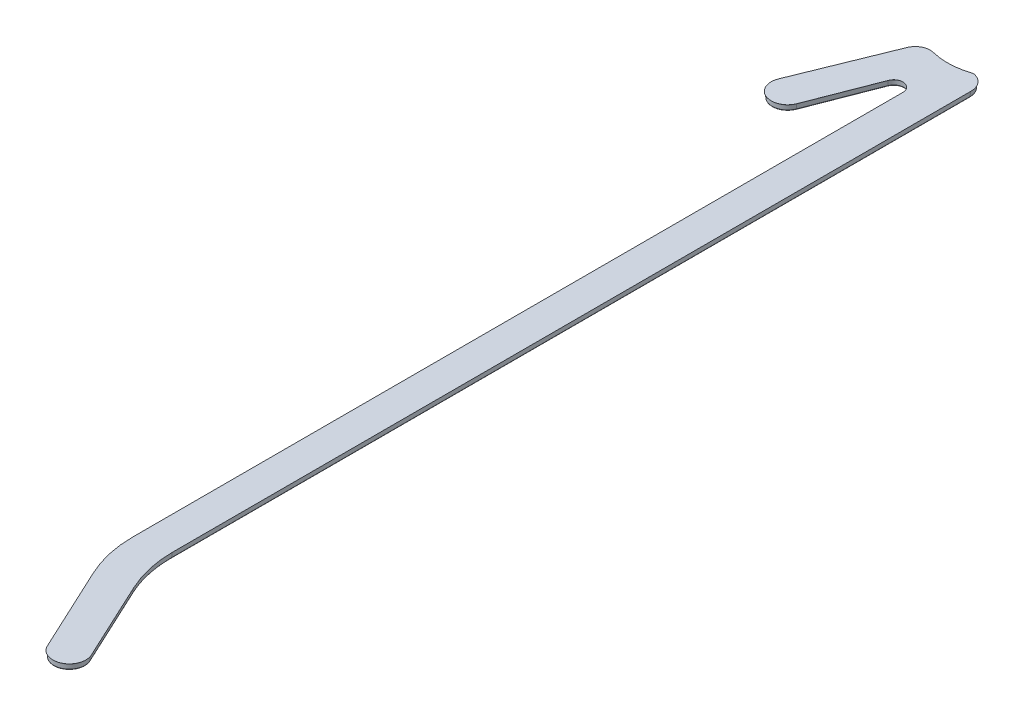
SolidWorks part; units mm, degrees
ref_plane "Plane1" through (0, 0, 0) normal (0, 0, 1) x (1, 0, 0)
ref_plane "Plane2" through (0, 0, 0) normal (0, 1, 0) x (1, 0, 0)
ref_plane "Plane3" through (0, 0, 0) normal (1, 0, 0) x (0, 0, -1)
sketch "Sketch1" plane through (0, 0, 0) normal (0, 0, 1) x (1, 0, 0)
  line L0 (-40, 5) -> (40, 5)
  line L1 (-40, 5) -> (-40, 0)
  line L2 (40, 0) -> (-40, 0)
  line L3 (40, 0) -> (40, 5)
  line L4 (0, 5) -> (0, 0) construction
  line L5 (50, 0) -> (-50, 0) construction
  dimension "D1" = 80
  dimension "D2" = 5
extrude "Base-Extrude" add sketch "Sketch1" along normal blind 300 and the other way blind 30
sketch "Sketch10" plane through (0, 0, 0) normal (0, 1, 0) x (-1, 0, 0)
  line L4 (2.5, 97.5) -> (2.5, -97.5) construction
  line L5 (0, 50) -> (0, -50) construction
  line L6 (-2.5, 97.5) -> (-2.5, -97.5) construction
  line L8 (-2.5, 0) -> (2.5, 0) construction
  arc A0 (2.5, -97.5) -> (-2.5, -97.5) centre (0, -97.5) cw construction
  arc A1 (-2.5, 97.5) -> (2.5, 97.5) centre (0, 97.5) cw construction
  dimension "Rib Length" = 200
  dimension "Rib Width" = 5
ref_plane "Plane4" through (0, 0, -97.5) normal (0, 0, 1) x (1, 0, 0)
ref_plane "Plane5" through (0, 0, 97.5) normal (0, 0, 1) x (1, 0, 0)
sketch "Sketch2" plane through (0, 0, -97.5) normal (0, -1, 0) x (1, 0, 0)
  line L1 (0, 97.5) -> (0, 307.5) construction
  line L2 (-4, 106.4577) -> (-4, 301.7359)
  line L3 (4, 97.5) -> (4, 306.6132)
  line L4 (0, 307.5) -> (12.6785, 334.6892) construction
  line L5 (-1.1892, 314.4145) -> (9.0533, 336.3797)
  line L6 (4, 306.6132) -> (16.3038, 332.9988)
  line L7 (0, 97.5) -> (-10, 97.5) construction
  line L8 (-10, 97.5) -> (-19.0325, 120.8112) construction
  line L9 (-13.3508, 96.142) -> (-22.7396, 119.3089)
  line L10 (-8.8311, 105.5545) -> (-15.3027, 122.2564)
  line L11 (-5, 97.5) -> (-5, 77.5) construction
  arc A0 (0.6118, 93.5471) -> (4, 97.5) centre (0, 97.5) ccw
  arc A1 (-13.3508, 96.142) -> (-9.1231, 93.9924) centre (-10, 97.5) ccw
  arc A2 (-15.3027, 122.2564) -> (-22.7396, 119.3089) centre (-19.0325, 120.8112) ccw
  arc A3 (16.3038, 332.9988) -> (9.0533, 336.3797) centre (12.6785, 334.6892) ccw
  arc A4 (-1.1892, 314.4145) -> (-4, 301.7359) centre (26, 301.7359) ccw
  arc A5 (0.6118, 93.5471) -> (-9.1231, 93.9924) centre (-5, 77.5) ccw
  arc A6 (-8.8311, 105.5545) -> (-4, 106.4577) centre (-6.5, 106.4577) ccw
  point P2 (0, 97.5)
  point P3 (-20.9967, 117.3267)
  point P6 (0.6118, 93.5471)
  point P23 (-19.0325, 121.1782)
  point P27 (-16.5453, 114.3924)
  point P28 (-22.7388, 119.3068)
  point P29 (-12.992, 99.5298)
  point P30 (0, 0)
  dimension "D1" = 4
  dimension "D3" = 4
  dimension "D6" = 10
  dimension "D7" = 4
  dimension "D10" = 20
  dimension "D12" = 4
  dimension "D11" = 5
  dimension "D13" = 30
  dimension "D14" = 17
  dimension "D2" = 210
  dimension "D4" = 30
  dimension "D5" = 155
  dimension "D8" = 25
  dimension "D9" = 21.18
extrude "Boss-Extrude1" add sketch "Sketch2" along normal blind 1.5 draft 3
sketch "Sketch7" plane through (0, -1.5, 0) normal (0, -1, 0) x (1, 0, 0)
  line L0 (0, 0.9975) -> (0, -17.5521) construction
  line L1 (0, 0) -> (0, -2)
  line L2 (3.9214, 0) -> (3.9214, 209.1306)
  line L3 (3.9214, 0) -> (3.9214, 209.1306)
  line L6 (-3.9214, 8.9577) -> (-3.9214, 204.2359)
  line L7 (-3.9214, 8.9577) -> (-3.9214, 204.2359)
  line L10 (3.9214, 209.1306) -> (16.2325, 235.532)
  line L11 (3.9214, 209.1306) -> (16.2325, 235.532)
  line L12 (-1.118, 216.8813) -> (9.1246, 238.8465)
  line L13 (-1.118, 216.8813) -> (9.1246, 238.8465)
  line L16 (-8.9044, 8.0261) -> (-15.376, 24.728)
  line L17 (-8.9044, 8.0261) -> (-15.376, 24.728)
  line L18 (-13.278, -1.3285) -> (-22.6668, 21.8384)
  line L19 (-13.278, -1.3285) -> (-22.6668, 21.8384)
  arc A2 (0.619, -3.8722) -> (3.9214, 0) centre (0, 0) ccw
  arc A3 (0.619, -3.8722) -> (3.9214, 0) centre (0, 0) ccw
  arc A4 (16.2325, 235.532) -> (9.1246, 238.8465) centre (12.6785, 237.1892) ccw
  arc A5 (16.2325, 235.532) -> (9.1246, 238.8465) centre (12.6785, 237.1892) ccw
  arc A7 (-1.118, 216.8813) -> (-3.9214, 204.2359) centre (26, 204.2359) ccw
  arc A8 (-1.118, 216.8813) -> (-3.9214, 204.2359) centre (26, 204.2359) ccw
  arc A13 (-8.9044, 8.0261) -> (-3.9214, 8.9577) centre (-6.5, 8.9577) ccw
  arc A14 (-8.9044, 8.0261) -> (-3.9214, 8.9577) centre (-6.5, 8.9577) ccw
  arc A15 (-15.376, 24.728) -> (-22.6668, 21.8384) centre (-19.0325, 23.3112) ccw
  arc A16 (-15.376, 24.728) -> (-22.6668, 21.8384) centre (-19.0325, 23.3112) ccw
  arc A17 (-13.278, -1.3285) -> (-9.1422, -3.4313) centre (-10, 0) ccw
  arc A18 (-13.278, -1.3285) -> (-9.1422, -3.4313) centre (-10, 0) ccw
  arc A19 (0.619, -3.8722) -> (-9.1422, -3.4313) centre (-5, -20) ccw
  arc A20 (0.619, -3.8722) -> (-9.1422, -3.4313) centre (-5, -20) ccw
  point P6 (0, -17.5521)
  point P15 (0, 0)
  dimension "D1" = 0
fillet "Congé1" radius 30 1 edges at (3.9607, -0.75, 209.1219)
fillet "Congé2" radius 0.2 28 edges at (-20.5063, 0, 27.0298) (-18.0452, 0, 10.2254) (-11.6387, 0, -3.2229) (-4.2231, 0, -3.0178) (3.037, 0, -2.6032) (4, 0, 101.2357) (4.7101, 0, 208.9558) (-12.0669, 0, 16.4055) (-6.0406, 0, 6.5003) (-4, 0, 106.5968) (-3.2889, 0, 210.7291) (3.932, 0, 227.8971) (14.369, 0, 240.8145) (4.0033, -1.5, 227.8639) (14.3358, -1.5, 240.7432) (11.4804, -1.5, 225.341) (4.6315, -1.5, 208.9732) (3.9214, -1.5, 101.2445) (2.9837, -1.5, -2.5446) (-4.2294, -1.5, -2.9388) (-11.603, -1.5, -3.1528) (-17.9724, -1.5, 10.255) (-20.4773, -1.5, 26.9567) (-12.1402, -1.5, 16.3771) (-6.0261, -1.5, 6.4231) (-3.9214, -1.5, 106.5968) (-3.2121, -1.5, 210.7121) (11.5553, 0, 225.3157)
sketch "Sketch3" plane through (-40, 0, 0) normal (-1, 0, 0) x (0, 0, 1)
  line L4 (-30, 0) -> (300, 0)
  line L5 (300, 0) -> (300, 5)
  line L6 (300, 5) -> (-30, 5)
  line L7 (-30, 5) -> (-30, 0)
  line L8 (-30, 0) -> (300, 0)
  line L9 (300, 0) -> (300, 5)
  line L10 (300, 5) -> (-30, 5)
  line L11 (-30, 5) -> (-30, 0)
  dimension "D1" = 0
extrude "Cut-Extrude1" cut sketch "Sketch3" against normal through all
sketch "Orientation Sketch" plane through (0, 0, 0) normal (0, 1, 0) x (-1, 0, 0)
  line L2 (-4.1898, 202.4737) -> (-4.1898, 0)
  line L3 (-4.1898, 202.4737) -> (-4.1898, 0)
  line L4 (13.5267, -1.4293) -> (22.9155, 21.7376)
  line L5 (13.5267, -1.4293) -> (22.9155, 21.7376)
  line L10 (15.1257, 24.825) -> (8.6542, 8.1231)
  line L11 (15.1257, 24.825) -> (8.6542, 8.1231)
  line L12 (4.1898, 8.9577) -> (4.1898, 204.2359)
  line L13 (4.1898, 8.9577) -> (4.1898, 204.2359)
  line L14 (1.3612, 216.9947) -> (-8.8813, 238.9599)
  line L15 (1.3612, 216.9947) -> (-8.8813, 238.9599)
  line L16 (-16.4758, 235.4186) -> (-6.978, 215.0505)
  line L17 (-16.4758, 235.4186) -> (-6.978, 215.0505)
  arc A2 (-4.1898, 0) -> (-0.5932, -4.1476) centre (0, 0) ccw
  arc A3 (-4.1898, 0) -> (-0.5932, -4.1476) centre (0, 0) ccw
  arc A4 (9.0771, -3.6917) -> (-0.5932, -4.1476) centre (5, -20) ccw
  arc A5 (9.0771, -3.6917) -> (-0.5932, -4.1476) centre (5, -20) ccw
  arc A11 (9.0771, -3.6917) -> (13.5267, -1.4293) centre (10, 0) ccw
  arc A12 (9.0771, -3.6917) -> (13.5267, -1.4293) centre (10, 0) ccw
  arc A13 (22.9155, 21.7376) -> (15.1257, 24.825) centre (19.0325, 23.3112) ccw
  arc A14 (22.9155, 21.7376) -> (15.1257, 24.825) centre (19.0325, 23.3112) ccw
  arc A15 (4.1898, 8.9577) -> (8.6542, 8.1231) centre (6.5, 8.9577) ccw
  arc A16 (4.1898, 8.9577) -> (8.6542, 8.1231) centre (6.5, 8.9577) ccw
  arc A17 (4.1898, 204.2359) -> (1.3612, 216.9947) centre (-26, 204.2359) ccw
  arc A18 (4.1898, 204.2359) -> (1.3612, 216.9947) centre (-26, 204.2359) ccw
  arc A19 (-8.8813, 238.9599) -> (-16.4758, 235.4186) centre (-12.6785, 237.1892) ccw
  arc A20 (-8.8813, 238.9599) -> (-16.4758, 235.4186) centre (-12.6785, 237.1892) ccw
  ellipse E1 centre (-34.0307, 202.4556) end of major axis (-4.8952, 208.9148) minor radius 29.8 (-4.1898, 202.4737) -> (-6.978, 215.0505) ccw
  ellipse E2 centre (-34.0307, 202.4556) end of major axis (-4.8952, 208.9148) minor radius 29.8 (-4.1898, 202.4737) -> (-6.978, 215.0505) ccw
  dimension "D1" = 0
